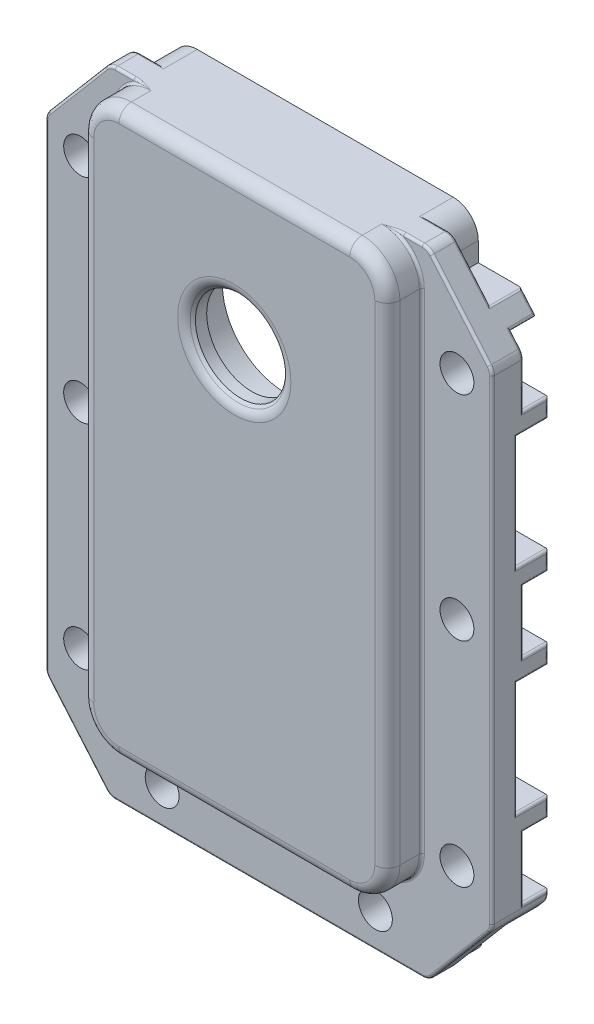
SolidWorks part; units mm, degrees
ref_plane "Face" through (0, 0, 0) normal (0, 0, 1) x (1, 0, 0)
ref_plane "Dessus" through (0, 0, 0) normal (0, 1, 0) x (1, 0, 0)
ref_plane "Droite" through (0, 0, 0) normal (1, 0, 0) x (0, 0, -1)
imported_body "Importée1"
sketch "Esquisse2" plane through (0, 0, 16.5) normal (0, 0, -1) x (-1, 0, 0)
  circle A0 centre (0, 0) radius 3.6 construction
  circle A1 centre (0, 0) radius 5
  circle A2 centre (0, 0) radius 5
  circle A3 centre (0, 0) radius 3.6
  dimension "D1" = 0
extrude "Extrusion1" add sketch "Esquisse2" along normal blind 0.15
sketch "Etiquette_MX-28"
sketch "Esquisse3" plane through (0, 0, 15.8) normal (0, 0, -1) x (-1, 0, 0)
  circle A0 centre (-4.8829, -11.053) radius 1
  circle A1 centre (-4.8829, -11.053) radius 2.5
  circle A2 centre (-4.8829, -11.053) radius 2.5
  circle A3 centre (-4.8829, -11.053) radius 1 construction
  dimension "D1" = 0
extrude "Extrusion2" add sketch "Esquisse3" along normal blind 0.15
sketch "Esquisse4" plane through (0, 0, 14) normal (0, 0, -1) x (-1, 0, 0)
  circle A0 centre (3.2526, -11.3654) radius 0.8
  circle A1 centre (3.2526, -11.3654) radius 0.8 construction
  arc A2 (1.33, -12.9634) -> (1.4582, -9.6246) centre (3.2526, -11.3654) ccw
  arc A3 (1.33, -12.9634) -> (1.4582, -9.6246) centre (-4.8829, -11.053) ccw
  arc A4 (1.33, -12.9634) -> (1.4582, -9.6246) centre (3.2526, -11.3654) ccw
  arc A5 (1.33, -12.9634) -> (1.4582, -9.6246) centre (-4.8829, -11.053) ccw
  dimension "D1" = 0
extrude "Extrusion3" add sketch "Esquisse4" along normal blind 0.35
